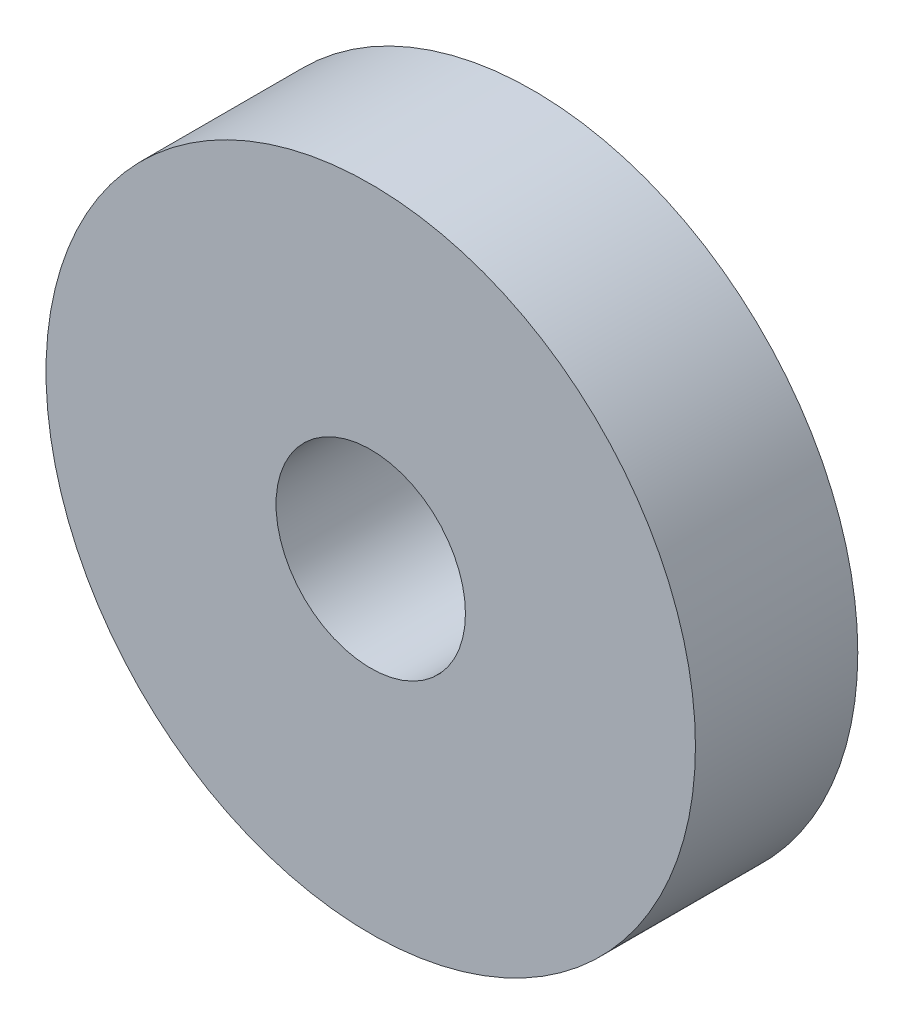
SolidWorks part; units mm, degrees
ref_plane "Plan de face" through (0, 0, 0) normal (0, 0, 1) x (1, 0, 0)
ref_plane "Plan de dessus" through (0, 0, 0) normal (0, 1, 0) x (1, 0, 0)
ref_plane "Plan de droite" through (0, 0, 0) normal (1, 0, 0) x (0, 0, -1)
sketch "Esquisse1" plane through (0, 0, 0) normal (0, 0, 1) x (1, 0, 0)
  circle A0 centre (0, 0) radius 1.75
  circle A1 centre (0, 0) radius 6
  dimension "D1" = 3.5
  dimension "D2" = 12
extrude "Boss.-Extru.1" add sketch "Esquisse1" along normal blind 3
